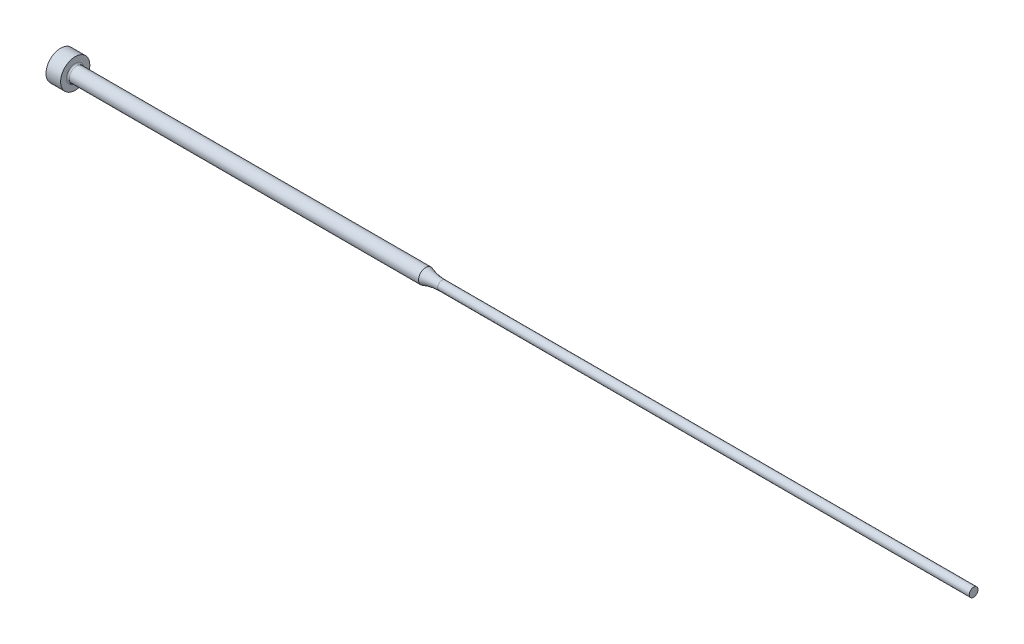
SolidWorks part; units mm, degrees
ref_plane "Front Plane" through (0, 0, 0) normal (0, 0, 1) x (1, 0, 0)
ref_plane "Top Plane" through (0, 0, 0) normal (0, 1, 0) x (1, 0, 0)
ref_plane "Right Plane" through (0, 0, 0) normal (1, 0, 0) x (0, 0, -1)
sketch "Sketch1" plane through (0, 0, 0) normal (0, 0, 1) x (1, 0, 0)
  line L0 (126.175, 1.1813) -> (1.175, 1.1813) construction
  line L1 (1.175, 1.1813) -> (1.175, 3.1812)
  line L2 (1.175, 3.1812) -> (3.175, 3.1812)
  line L3 (3.175, 3.1812) -> (3.175, 2.3812)
  line L4 (3.375, 2.1813) -> (51.175, 2.1813)
  line L5 (53.3931, 1.7813) -> (126.175, 1.7813)
  line L6 (126.175, 1.7813) -> (126.175, 1.1813)
  line L7 (126.175, 1.1813) -> (1.175, 1.1813)
  line L8 (1.175, 1.1813) -> (-6.6732, 1.1812) construction
  line L9 (108.5929, 1.1813) -> (126.175, 1.1813) construction
  arc A0 (3.175, 2.3812) -> (3.375, 2.1813) centre (3.375, 2.3813) ccw
  arc A1 (51.175, 2.1813) -> (53.3931, 1.7813) centre (53.3931, 8.1313) ccw
  dimension "D1" = 0.2
  dimension "D2" = 6.35
  dimension "PinDia" = 1.2
  dimension "HeadDia" = 4
  dimension "HeadThickness" = 2
  dimension "Shoulder" = 50
  dimension "OverallLength" = 125
  dimension "ShoulderDia" = 2
revolve "Revolve1" add sketch "Sketch1" angle 360 about L0
